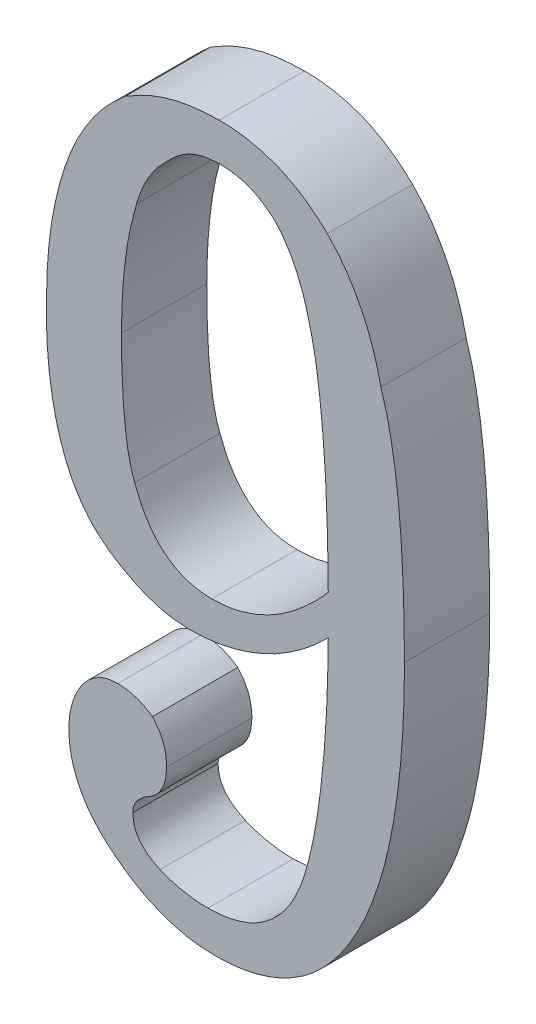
SolidWorks part; units mm, degrees
ref_plane "前基準面" through (0, 0, 0) normal (0, 0, 1) x (1, 0, 0)
ref_plane "上基準面" through (0, 0, 0) normal (0, 1, 0) x (1, 0, 0)
ref_plane "右基準面" through (0, 0, 0) normal (1, 0, 0) x (0, 0, -1)
sketch "草圖1" plane through (0, 0, 0) normal (0, 0, 1) x (1, 0, 0)
  text T0 "9" font "標楷體" height 25
extrude "填料-伸長1" add sketch "草圖1" along normal blind 3
